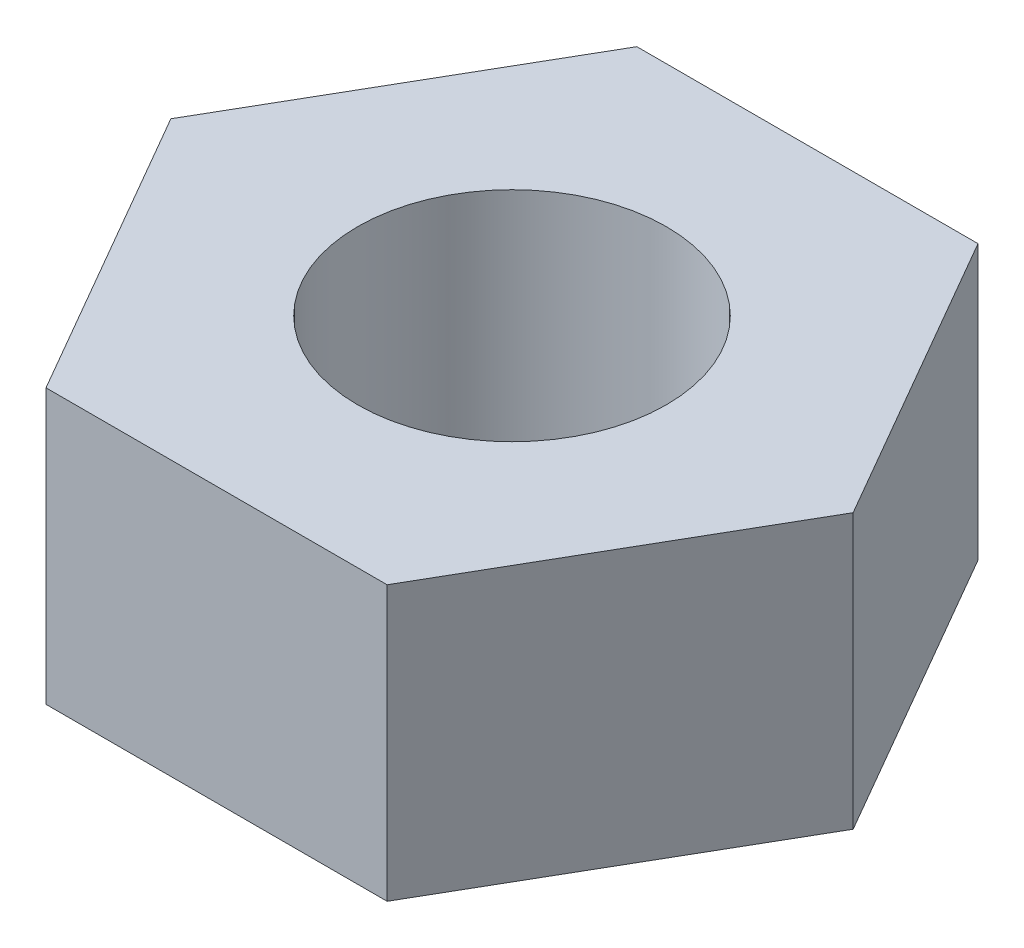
SolidWorks part; units mm, degrees
ref_plane "Front Plane" through (0, 0, 0) normal (0, 0, 1) x (1, 0, 0)
ref_plane "Top Plane" through (0, 0, 0) normal (0, 1, 0) x (1, 0, 0)
ref_plane "Right Plane" through (0, 0, 0) normal (1, 0, 0) x (0, 0, -1)
sketch "Sketch-Hex" plane through (0, 0, 0) normal (0, 1, 0) x (1, 0, 0)
  line L0 (0, 2.8194) -> (0, -2.8194) construction
  line L1 (3.2556, 0) -> (1.6278, 2.8194)
  line L2 (1.6278, 2.8194) -> (-1.6278, 2.8194)
  line L3 (-1.6278, 2.8194) -> (-3.2556, 0)
  line L4 (-3.2556, 0) -> (-1.6278, -2.8194)
  line L5 (-1.6278, -2.8194) -> (1.6278, -2.8194)
  line L6 (1.6278, -2.8194) -> (3.2556, 0)
  line L7 (-3.2556, 0) -> (3.2556, 0) construction
  circle A0 centre (0, 0) radius 2.8194 construction
  dimension "D1" = 5.6388
extrude "Boss-Extrude1" add sketch "Sketch-Hex" along normal blind 2.6162
sketch "Sketch4" plane through (0, 0, 0) normal (0, -1, 0) x (1, 0, 0)
  line L0 (-3.2556, 0) -> (3.2556, 0) construction
  line L1 (0, -2.8194) -> (0, 2.8194) construction
  line L2 (1.6278, -2.8194) -> (-1.6278, -2.8194) construction
  line L3 (-1.6278, 2.8194) -> (1.6278, 2.8194) construction
  circle A0 centre (0, 0) radius 1.4732
  dimension "D1" = 2.9464
extrude "Cut-Extrude1" cut sketch "Sketch4" against normal through all
